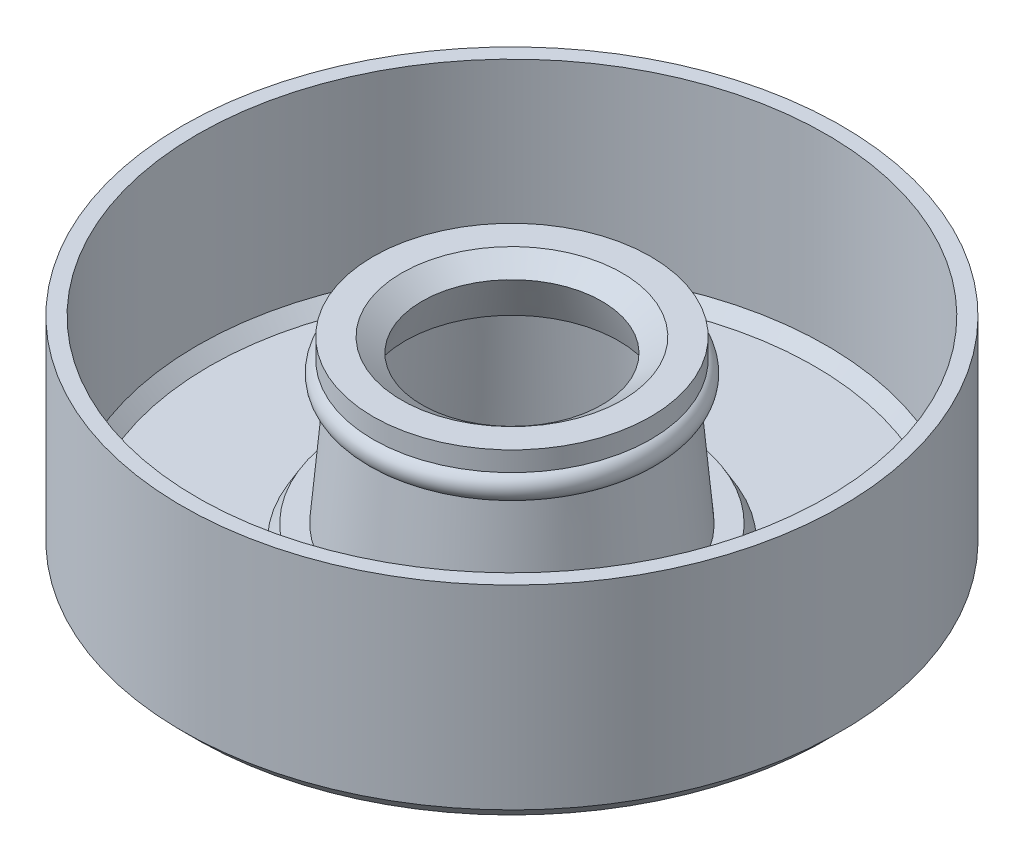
SolidWorks part; units mm, degrees
ref_plane "前视基准面" through (0, 0, 0) normal (0, 0, 1) x (1, 0, 0)
ref_plane "上视基准面" through (0, 0, 0) normal (0, 1, 0) x (1, 0, 0)
ref_plane "右视基准面" through (0, 0, 0) normal (1, 0, 0) x (0, 0, -1)
sketch "草图1" plane through (0, 0, 0) normal (0, 0, 1) x (1, 0, 0)
  line L0 (-10.5, 0) -> (-5.7694, 0)
  line L1 (-10.1, 0.5) -> (-5.7694, 0.5)
  line L2 (-11, 7) -> (-11, 0.5)
  line L3 (-10.5, 0.9) -> (-10.5, 7)
  line L4 (-10.5, 0.9) -> (-10.1, 0.5)
  line L5 (-11, 0.5) -> (-10.5, 0)
  line L6 (-4.4325, 4.9) -> (-4.7737, 1)
  line L7 (-10.5, 7) -> (-11, 7)
  line L8 (-3, 5.9286) -> (-3.6801, 6.4048)
  line L9 (-3.5655, 4.5) -> (-3, 5.9286)
  line L10 (-4.3155, 0.5) -> (-3.9655, 4.5)
  line L11 (-4.7737, 1) -> (-5.4808, 1)
  line L12 (-4.3155, 0) -> (-4.8797, 0.5)
  line L13 (-5.4808, 1) -> (-5.4808, 0.5) construction
  line L14 (-4.3155, 0.5) -> (-3.5655, 0.0656)
  line L15 (-4.3155, 0) -> (-3.5655, 0.0656)
  line L16 (-3.6801, 6.4048) -> (-4.6325, 6.4048)
  line L17 (-4.6325, 6.4048) -> (-4.6325, 5.7472)
  line L18 (-3.5655, 4.5) -> (-3.9655, 4.5)
  line L19 (0, 5.9773) -> (0, -9.5227) construction
  line L20 (-10.5, 0) -> (-10.5, 0.5) construction
  line L21 (-5.4808, 1) -> (-5.7694, 0.5)
  line L22 (-4.5867, 3.137) -> (-4.0886, 3.0934) construction
  line L23 (-10.5, 0.9) -> (-10.1, 0.9) construction
  line L24 (-4.4325, 5.3472) -> (-4.8797, 5.3472) construction
  arc A0 (-4.6325, 5.7472) -> (-4.4325, 4.9) centre (-4.4325, 5.3472) ccw
  arc A1 (-5.7694, 0) -> (-4.8797, 0.5) centre (-5.7694, 1.0417) ccw
  dimension "D12" = 120
  dimension "D2" = 135
  dimension "D3" = 0.4
  dimension "D4" = 145
  dimension "D5" = 0.2
  dimension "D6" = 45
  dimension "D7" = 4.5
  dimension "b" = 7
  dimension "D8" = 1.4286
  dimension "D9" = 0.4762
  dimension "D10" = 0.4
  dimension "D11" = 5
  dimension "D13" = 0.9524
  dimension "D14" = 95
  dimension "D15" = 0.4
  dimension "d1" = 6
  dimension "dm" = 22
  dimension "r" = 0.5
revolve "旋转1" add sketch "草图1" angle 360 about L19
equation "\"D7@草图1\" = \"b@草图1\" / 2 + 1"
equation "\"D8@草图1\" =  ( \"b@草图1\" - \"D7@草图1\" )  / 7 * 4"
equation "\"D9@草图1\" = \"D8@草图1\" / 3"
equation "\"D13@草图1\" = \"D9@草图1\" * 2"
equation "\"D3@草图1\" = \"r@草图1\" / 5 * 4"
equation "\"D10@草图1\" = \"D3@草图1\""
equation "\"D5@草图1\" = \"D3@草图1\" / 2"
equation "\"D15@草图1\" = \"D3@草图1\""
